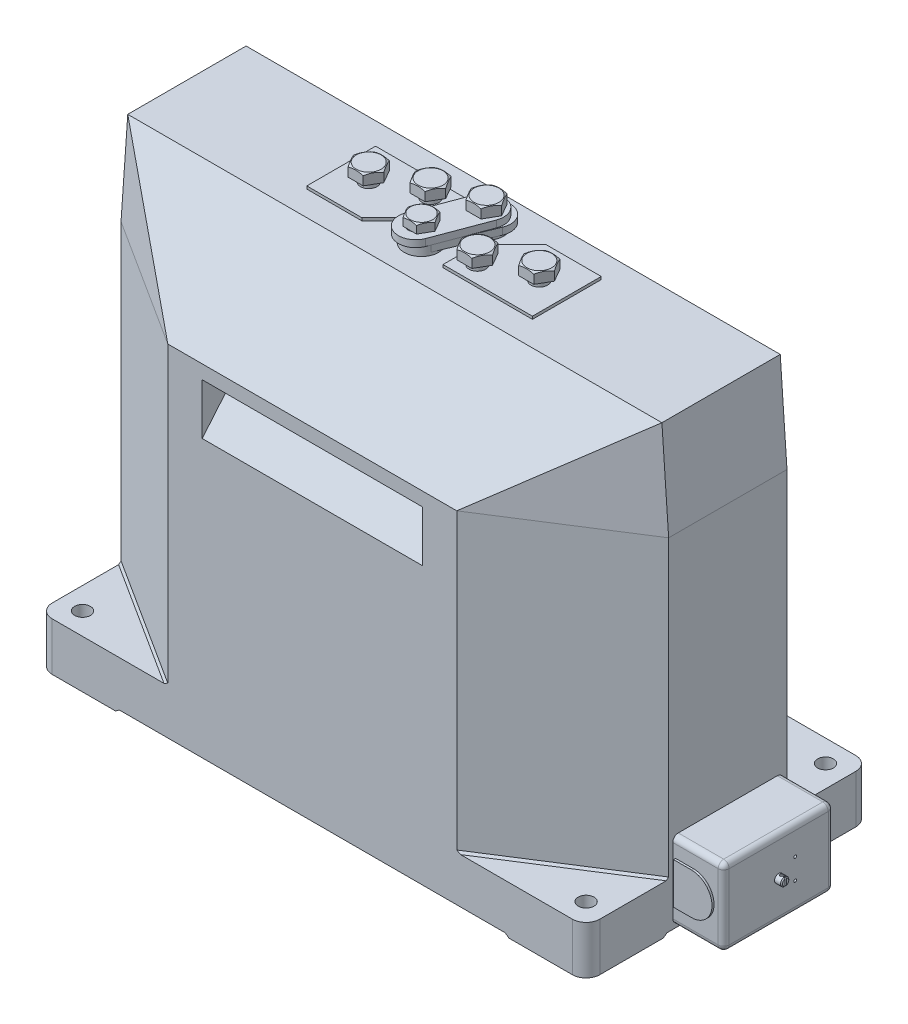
SolidWorks part; units mm, degrees
ref_plane "Front Plane" through (0, 0, 0) normal (0, 0, 1) x (1, 0, 0)
ref_plane "Top Plane" through (0, 0, 0) normal (0, 1, 0) x (1, 0, 0)
ref_plane "Right Plane" through (0, 0, 0) normal (1, 0, 0) x (0, 0, -1)
other "Join1"
other "FME12_Tömszelence_29519_112<2>@24305_AM-40b_Körvonalrajzhoz"
other "FME12_Tömszelence_29519_112<1>@24305_AM-40b_Körvonalrajzhoz"
other "21105-115_PlombaCsavar<1>@24305_AM-40b_Körvonalrajzhoz"
other "FME12_TRA_Kapocsfedél_29519_113<1>@24305_AM-40b_Körvonalrajzhoz"
other "HlTmCsDIN933<5>@24305_AM-40b_Körvonalrajzhoz"
other "HlTmCsDIN933<3>@24305_AM-40b_Körvonalrajzhoz"
other "HlTmCsDIN933<6>@24305_AM-40b_Körvonalrajzhoz"
other "HlTmCsDIN933<7>@24305_AM-40b_Körvonalrajzhoz"
other "24205-124_ÁtkötőLamella<1>@24305_AM-40b_Körvonalrajzhoz"
other "24205-124_ÁtkötőLamella<2>@24305_AM-40b_Körvonalrajzhoz"
other "HlTmCsDIN933<4>@24305_AM-40b_Körvonalrajzhoz"
other "HlTmCsDIN933<2>@24305_AM-40b_Körvonalrajzhoz"
other "HlTmCsDIN933<1>@24305_AM-40b_Körvonalrajzhoz"
other "AM40b_TRA_Kiöntött_Körvonalrajzhoz<1>@24305_AM-40b_Körvonalrajzhoz/AM40b_TRA_Test_T24305<1>@AM40b_TRA_Kiöntött_Körvonalrajzhoz"
